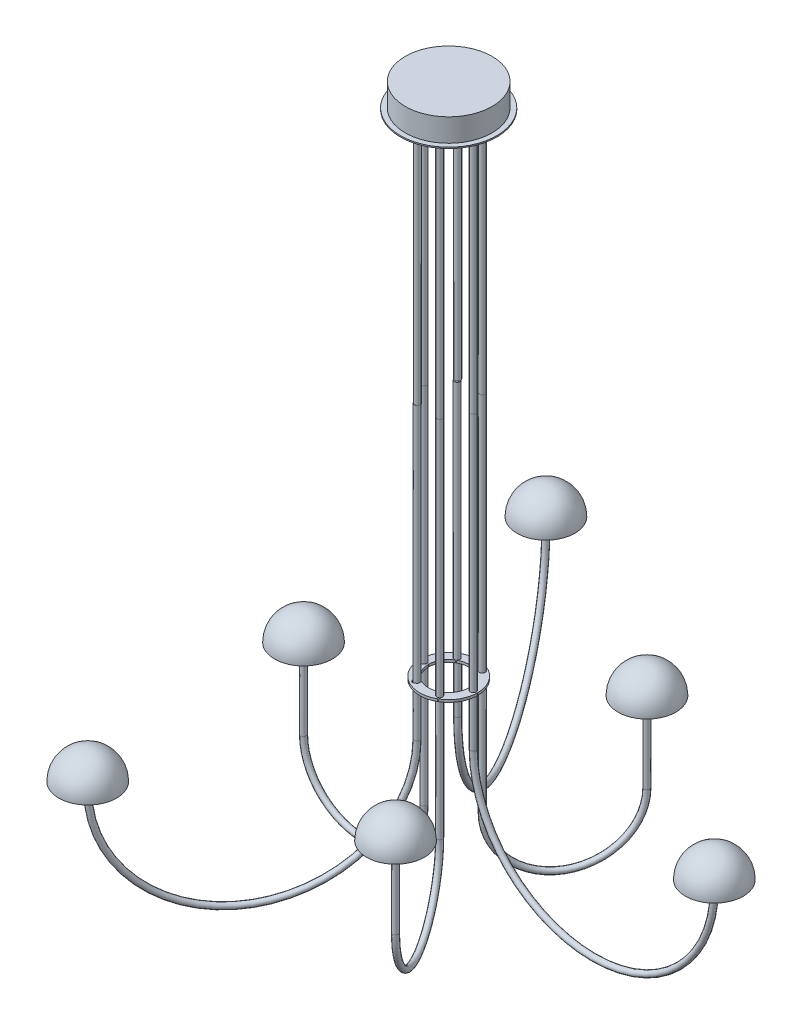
SolidWorks part; units mm, degrees
ref_plane "Alzado" through (0, 0, 0) normal (0, 0, 1) x (1, 0, 0)
ref_plane "Planta" through (0, 0, 0) normal (0, 1, 0) x (1, 0, 0)
ref_plane "Vista lateral" through (0, 0, 0) normal (1, 0, 0) x (0, 0, -1)
imported_body "Pieza3-1-solid1"
imported_body "Pieza1-1-solid1"
imported_body "Pieza4-19-solid1"
imported_body "Pieza4-19-solid2"
imported_body "Pieza4-19-solid3"
imported_body "Pieza2-2-solid1"
imported_body "Pieza2-3-solid1"
imported_body "Pieza5-1-solid1"
imported_body "Pieza5-1-solid2"
imported_body "Pieza5-1-solid3"
imported_body "Pieza5-1-solid4"
imported_body "Pieza5-1-solid5"
imported_body "Pieza5-1-solid8"
imported_body "Pieza4-20-solid1"
imported_body "Pieza4-20-solid2"
imported_body "Pieza4-20-solid3"
imported_body "Pieza4-21-solid1"
imported_body "Pieza4-21-solid2"
imported_body "Pieza4-21-solid3"
imported_body "Pieza1-6-solid1"
imported_body "Pieza1-7-solid1"
imported_body "Pieza2-15-solid1"
imported_body "Pieza2-16-solid1"
imported_body "Pieza2-19-solid1"
imported_body "Pieza2-20-solid1"
imported_body "Pieza1 - copia-1-solid1"
imported_body "Pieza4-16-solid1"
imported_body "Pieza4-16-solid2"
imported_body "Pieza4-16-solid3"
imported_body "Pieza2-23-solid1"
imported_body "Pieza2-24-solid1"
imported_body "Pieza2-29-solid1"
imported_body "Pieza2-30-solid1"
imported_body "Pieza2-31-solid1"
imported_body "Pieza2-32-solid1"
imported_body "Pieza1 - copia-4-solid1"
imported_body "Pieza1 - copia-5-solid1"
imported_body "Pieza4-17-solid1"
imported_body "Pieza4-17-solid2"
imported_body "Pieza4-17-solid3"
imported_body "Pieza4-18-solid1"
imported_body "Pieza4-18-solid2"
imported_body "Pieza4-18-solid3"
sketch "Croquis1" plane through (0, 1020.5, 0) normal (0, 1, 0) x (1, 0, 0)
  circle A0 centre (0, 0) radius 99.949
  dimension "D1" = 199.898
extrude "Saliente-Extruir1" add sketch "Croquis1" along normal blind 2.54
sketch "Croquis2" plane through (0, 1023.04, 0) normal (0, 1, 0) x (1, 0, 0)
  circle A0 centre (0, 0) radius 90.043
  dimension "D1" = 180.086
extrude "Saliente-Extruir2" add sketch "Croquis2" along normal blind 47.498
